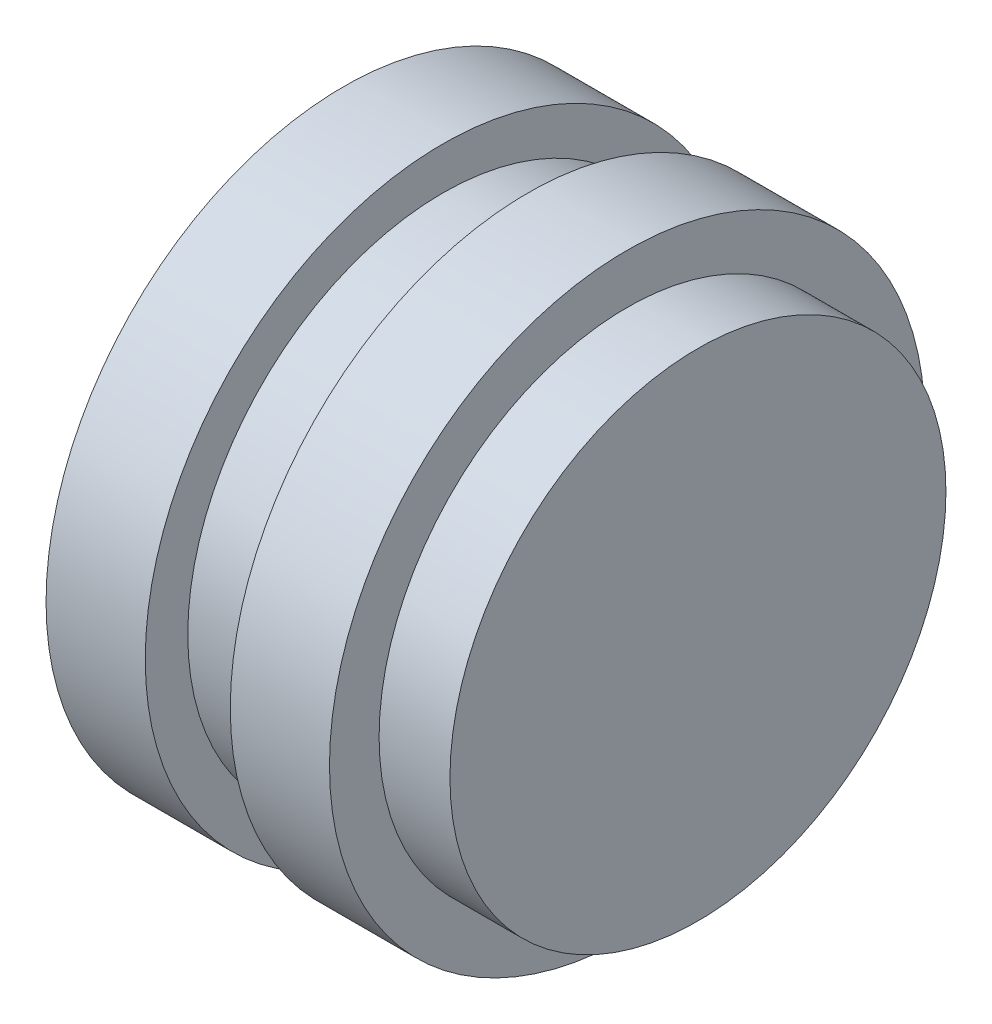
SolidWorks part; units mm, degrees
ref_plane "Face" through (0, 0, 0) normal (0, 0, 1) x (1, 0, 0)
ref_plane "Dessus" through (0, 0, 0) normal (0, 1, 0) x (1, 0, 0)
ref_plane "Droite" through (0, 0, 0) normal (1, 0, 0) x (0, 0, -1)
sketch "Esquisse1" plane through (0, 0, 0) normal (0, 0, 1) x (1, 0, 0)
  line L0 (35.4426, 0) -> (-38.695, 0) construction
  line L1 (11.5, 0) -> (11.5, 17.5)
  line L2 (6.5, 21) -> (-0.5, 21)
  line L3 (-0.5, 21) -> (-0.5, 18)
  line L4 (-0.5, 18) -> (-6.5, 18)
  line L5 (-6.5, 18) -> (-6.5, 21)
  line L6 (-6.5, 21) -> (-13.5, 21)
  line L7 (-13.5, 21) -> (-13.5, 0)
  line L8 (11.5, 0) -> (-13.5, 0)
  line L9 (6.5, 21) -> (6.5, 17.5)
  line L10 (6.5, 17.5) -> (11.5, 17.5)
  dimension "D1" = 42
  dimension "D2" = 7
  dimension "D3" = 7
  dimension "D4" = 25
  dimension "D5" = 6
  dimension "D6" = 3
  dimension "D7" = 11.5
  dimension "D8" = 35
revolve "Base-Révolution" add sketch "Esquisse1" angle 360 about L0
